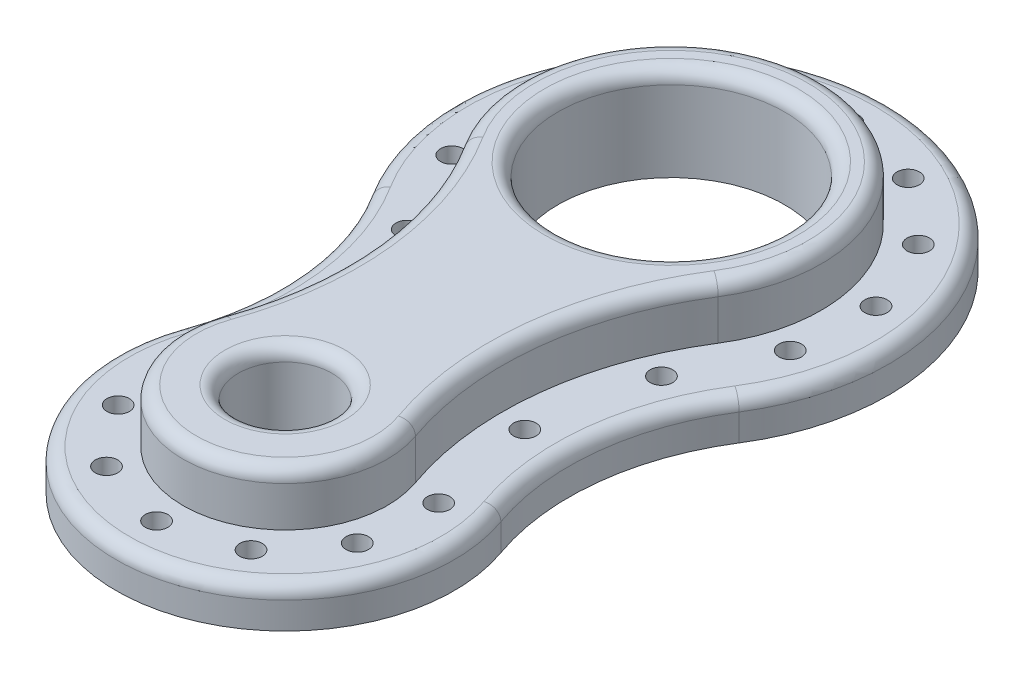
SolidWorks part; units mm, degrees
ref_plane "Front Plane" through (0, 0, 0) normal (0, 0, 1) x (1, 0, 0)
ref_plane "Top Plane" through (0, 0, 0) normal (0, 1, 0) x (1, 0, 0)
ref_plane "Right Plane" through (0, 0, 0) normal (1, 0, 0) x (0, 0, -1)
sketch "Sketch3"
extrude "Extrude3" add sketch "Sketch3" along normal blind 7.62
sketch "Sketch4"
  dimension "D1" = 12.7
extrude "Extrude4" add sketch "Sketch4" along normal blind 10.16
sketch "Sketch5"
extrude "Extrude5" cut sketch "Sketch5" against normal through all
sketch "Sketch6"
extrude "Extrude6" cut sketch "Sketch6" against normal through all
fillet "Fillet1" radius 2.54 4 edges at (0, 17.78, -101.643) (15.2434, 17.78, -32.8982) (0, 17.78, 19.3613) (-15.2434, 17.78, -32.8982)
fillet "Fillet2" radius 2.54 6 edges at (27.864, 7.62, -31.4804) (0, 7.62, 32.0613) (-27.864, 7.62, -31.4804) (0, 17.78, 8.8784) (0, 7.62, -114.343) (0, 17.78, -51.7083)
sketch "Sketch7"
  dimension "D1" = 24.384
extrude "Extrude7" cut sketch "Sketch7" against normal through all
pattern_curve "CrvPattern1" of "Extrude7" parameters "D1"=20, "D3"=50, "D2"=1, "D4"=50
